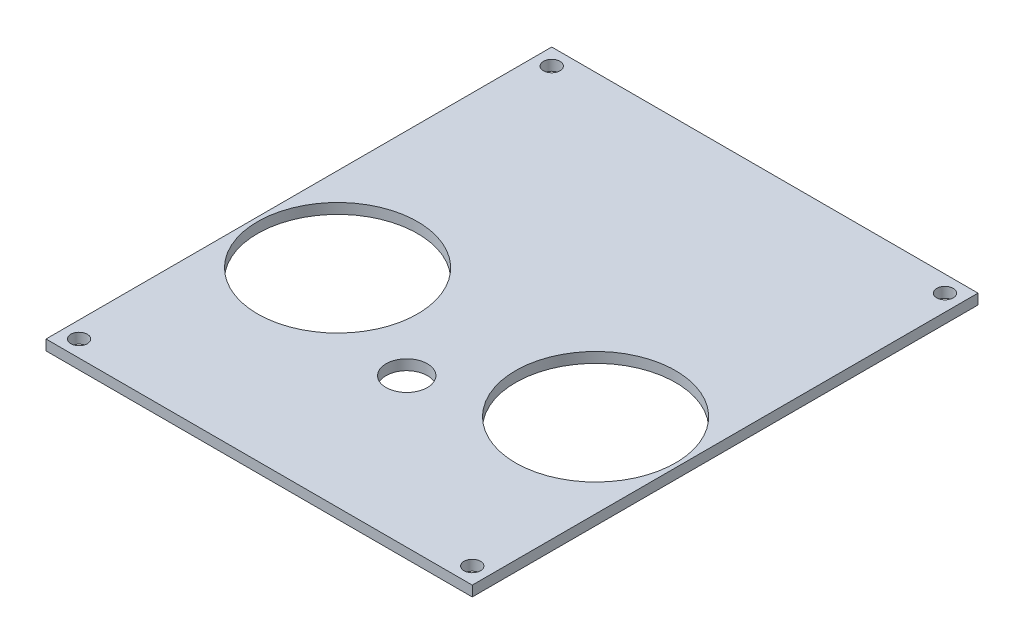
SolidWorks part; units mm, degrees
ref_plane "Front Plane" through (0, 0, 0) normal (0, 0, 1) x (1, 0, 0)
ref_plane "Top Plane" through (0, 0, 0) normal (0, 1, 0) x (1, 0, 0)
ref_plane "Right Plane" through (0, 0, 0) normal (1, 0, 0) x (0, 0, -1)
sketch "Sketch1" plane through (0, 0, 0) normal (0, 1, 0) x (1, 0, 0)
  line L1 (41.3, 49) -> (-41.3, 49)
  line L2 (41.3, 49) -> (41.3, -49)
  line L3 (41.3, -49) -> (-41.3, -49)
  line L4 (-41.3, 49) -> (-41.3, -49)
  line L5 (41.3, 49) -> (-41.3, -49) construction
  line L6 (41.3, -49) -> (-41.3, 49) construction
  point P0 (0, 0)
  dimension "D1" = 82.6
  dimension "D2" = 98
extrude "Boss-Extrude1" add sketch "Sketch1" along normal blind 2
hole_wizard "Ø3.2 (3.2) Diameter Hole1" positions "Sketch3" profile "Sketch2" hole size "Ø3.2" standard "ISO"
sketch "Sketch3" plane through (0, 2, 0) normal (0, 1, 0) x (1, 0, 0)
  line L0 (-41.3, 49) -> (-41.3, -49) construction
  line L1 (41.3, 49) -> (-41.3, 49) construction
  line L2 (41.3, -49) -> (41.3, 49) construction
  line L3 (-41.3, -49) -> (41.3, -49) construction
  point P0 (-38.1, 45.8)
  point P2 (38.1, 45.8)
  point P4 (38.1, -45.8)
  point P6 (-38.1, -45.8)
  dimension "D1" = 3.2
  dimension "D2" = 3.2
  dimension "D3" = 3.2
  dimension "D4" = 3.2
  dimension "D5" = 3.2
  dimension "D6" = 3.2
  dimension "D7" = 3.2
  dimension "D8" = 3.2
sketch "Sketch2" plane through (-38.1, 2, -45.8) normal (1, 0, 0) x (0, 0, 1)
  line L0 (0, 0) -> (0, 2)
  line L1 (0, 2) -> (1.6, 2)
  line L2 (1.6, 2) -> (1.6, 0)
  line L5 (1.6, 0) -> (0, 0)
  line L11 (0, -6.35) -> (0, 107.95) construction
  dimension "Thru Hole Dia." = 3.2
  dimension "Thru Hole Depth" = 2
sketch "Sketch4" plane through (0, 2, 0) normal (0, 1, 0) x (1, 0, 0)
  line L0 (-41.3, -49) -> (41.3, -49) construction
  line L3 (-41.3, 49) -> (-41.3, -49) construction
  circle A0 centre (-25, -8.8) radius 15.5
  circle A1 centre (25, -8.8) radius 15.5
  dimension "D1" = 31
  dimension "D2" = 31
  dimension "D3" = 40.2
  dimension "D4" = 50
  dimension "D6" = 16.3
extrude "Cut-Extrude1" cut sketch "Sketch4" against normal blind 2
sketch "Sketch5" plane through (0, 0, 0) normal (0, -1, 0) x (1, 0, 0)
  line L0 (-41.3, 49) -> (41.3, 49) construction
  line L1 (41.3, 49) -> (41.3, -49) construction
  circle A0 centre (-0.2, 20.2) radius 4
  dimension "D1" = 8
  dimension "D2" = 28.8
  dimension "D3" = 41.5
extrude "Cut-Extrude2" cut sketch "Sketch5" against normal blind 10
